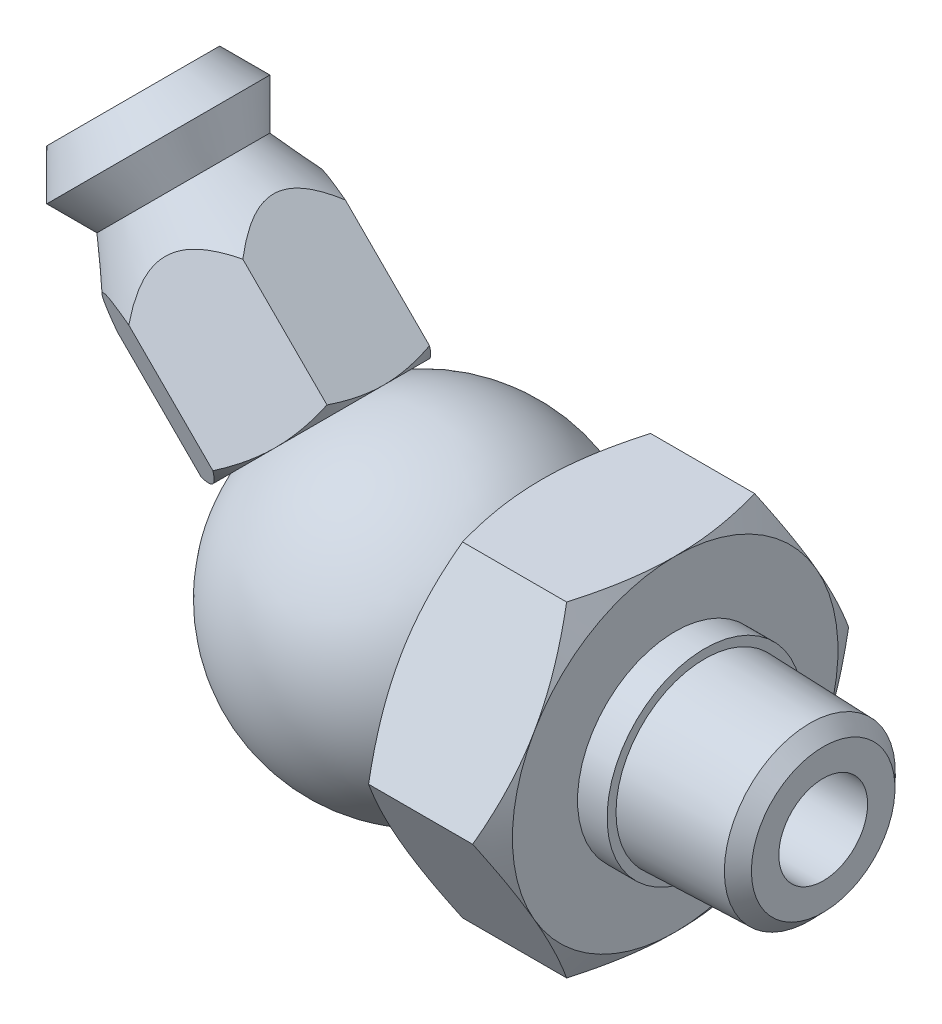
SolidWorks part; units mm, degrees
ref_plane "Plan de face" through (0, 0, 0) normal (0, 0, 1) x (1, 0, 0)
ref_plane "Plan de dessus" through (0, 0, 0) normal (0, 1, 0) x (1, 0, 0)
ref_plane "Plan de droite" through (0, 0, 0) normal (1, 0, 0) x (0, 0, -1)
imported_body "Importée1"
hole_wizard "Diamètre du perçage Ø2.5 (2.5)1" positions "Esquisse3D1" profile "Esquisse2" hole size "Ø2.5" standard "ISO"
sketch3d "Esquisse3D1"
  line L0 (-18.4626, 8.9626, 0) -> (-19.3111, 9.8111, 0) construction
  point P0 (-19.3111, 9.8111, 0)
sketch "Esquisse2" plane through (-19.3111, 9.8111, 0) normal (0, 0, 1) x (-0.7071, -0.7071, 0)
  line L0 (0, 0) -> (0, 15.7511)
  line L1 (0, 15.7511) -> (1.25, 15)
  line L2 (1.25, 15) -> (1.25, 0)
  line L5 (1.25, 0) -> (0, 0)
  line L10 (0, 15.7511) -> (-1.25, 15) construction
  line L11 (0, -6.35) -> (0, 107.95) construction
  dimension "Diamètre du perçage" = 2.5
  dimension "Profondeur du perçage" = 15
  dimension "Angle de pointe" = 118
hole_wizard "Diamètre du perçage Ø3.0 (3)2" positions "Esquisse4" profile "Esquisse3" hole size "Ø3.0" standard "ISO"
sketch "Esquisse4" plane through (4, 0, 0) normal (1, 0, 0) x (0, 0, -1)
  point P1 (0, 0)
sketch "Esquisse3" plane through (4, 0, 0) normal (0, 1, 0) x (0, 0, -1)
  line L0 (0, 0) -> (0, 17.9013)
  line L1 (0, 17.9013) -> (1.5, 17)
  line L2 (1.5, 17) -> (1.5, 0)
  line L5 (1.5, 0) -> (0, 0)
  line L10 (0, 17.9013) -> (-1.5, 17) construction
  line L11 (0, -6.35) -> (0, 107.95) construction
  dimension "Diamètre du perçage" = 3
  dimension "Profondeur du perçage" = 17
  dimension "Angle de pointe" = 118
